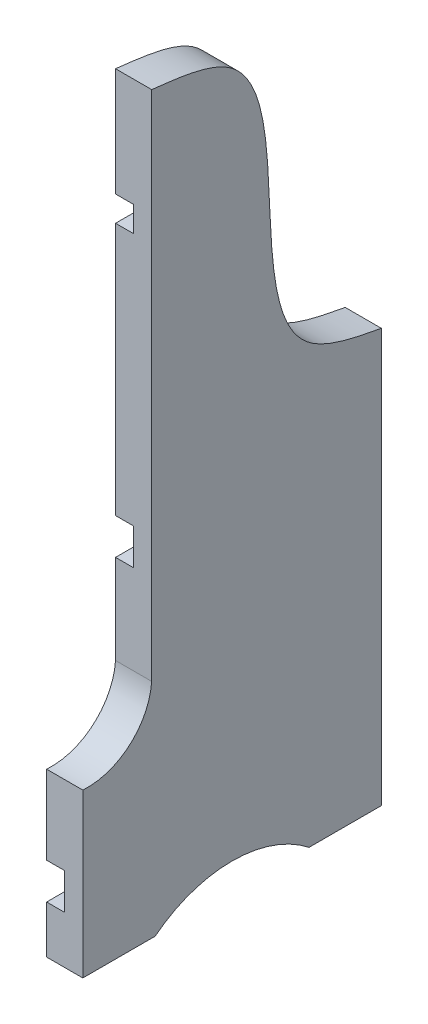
SolidWorks part; units mm, degrees
ref_plane "Front Plane" through (0, 0, 0) normal (0, 0, 1) x (1, 0, 0)
ref_plane "Top Plane" through (0, 0, 0) normal (0, 1, 0) x (1, 0, 0)
ref_plane "Right Plane" through (0, 0, 0) normal (1, 0, 0) x (0, 0, -1)
sketch "Sketch1" plane through (0, 0, 0) normal (1, 0, 0) x (0, 0, -1)
  line L0 (-51.941, 0) -> (-31.941, 0)
  line L1 (30.609, 0) -> (30.609, 114.3)
  line L2 (-51.941, 0) -> (-51.941, 45)
  line L3 (-32.891, 61.4979) -> (-32.891, 203.2)
  line L4 (30.609, 0) -> (10.609, 0)
  arc A0 (-32.891, 61.4979) -> (-51.941, 45) centre (-50.6649, 62.7739) cw
  arc A1 (-31.941, 0) -> (10.609, 0) centre (-10.666, -27.0078) cw
  spline S0 degree 3 poles (-32.891, 203.2) (-24.7894, 202.2844) (12.3984, 198.0814) (-12.7256, 122.3796) (23.1368, 115.6932) (30.609, 114.3) knots 0 0 0 0 0.180665 0.829285 1 1 1 1
  dimension "D1" = 82.55
  dimension "D2" = 45
  dimension "D3" = 203.2
  dimension "D4" = 63.5
  dimension "D5" = 20
  dimension "D6" = 20
extrude "Extrude1" add sketch "Sketch1" along normal blind 10
sketch "Sketch2" plane through (0, 0, 0) normal (1, 0, 0) x (0, 0, -1)
  line L1 (-33.405, 173.2) -> (-0.6224, 173.2)
  line L2 (-33.405, 173.2) -> (-33.405, 166.2)
  line L3 (-33.405, 166.2) -> (-0.6224, 166.2)
  line L4 (-0.6224, 173.2) -> (-0.6224, 166.2)
  spline S0 degree 3 poles (30.609, 114.3) (23.1368, 115.6932) (-12.7256, 122.3796) (12.3984, 198.0814) (-24.7894, 202.2844) (-32.891, 203.2) knots 0 0 0 0 0.170715 0.819335 1 1 1 1 construction
  dimension "D1" = 30
  dimension "D2" = 7
extrude "Cut-Extrude1" cut sketch "Sketch2" along normal blind 5
sketch "Sketch3" plane through (0, 0, 0) normal (1, 0, 0) x (0, 0, -1)
  line L0 (30.609, 0) -> (30.609, 114.3) construction
  line L1 (-33.0757, 96.2) -> (30.609, 96.2)
  line L2 (-33.0757, 96.2) -> (-33.0757, 86.2)
  line L3 (-33.0757, 86.2) -> (30.609, 86.2)
  line L4 (30.609, 96.2) -> (30.609, 86.2)
  dimension "D1" = 70
  dimension "D2" = 10
extrude "Cut-Extrude3" cut sketch "Sketch3" along normal blind 5
sketch "Sketch4" plane through (0, 0, 0) normal (1, 0, 0) x (0, 0, -1)
  line L1 (30.914, 23.2) -> (-52.3519, 23.2)
  line L2 (30.914, 23.2) -> (30.914, 13.2)
  line L3 (30.914, 13.2) -> (-52.3519, 13.2)
  line L4 (-52.3519, 23.2) -> (-52.3519, 13.2)
  dimension "D1" = 180
  dimension "D2" = 10
extrude "Cut-Extrude4" cut sketch "Sketch4" along normal blind 5
